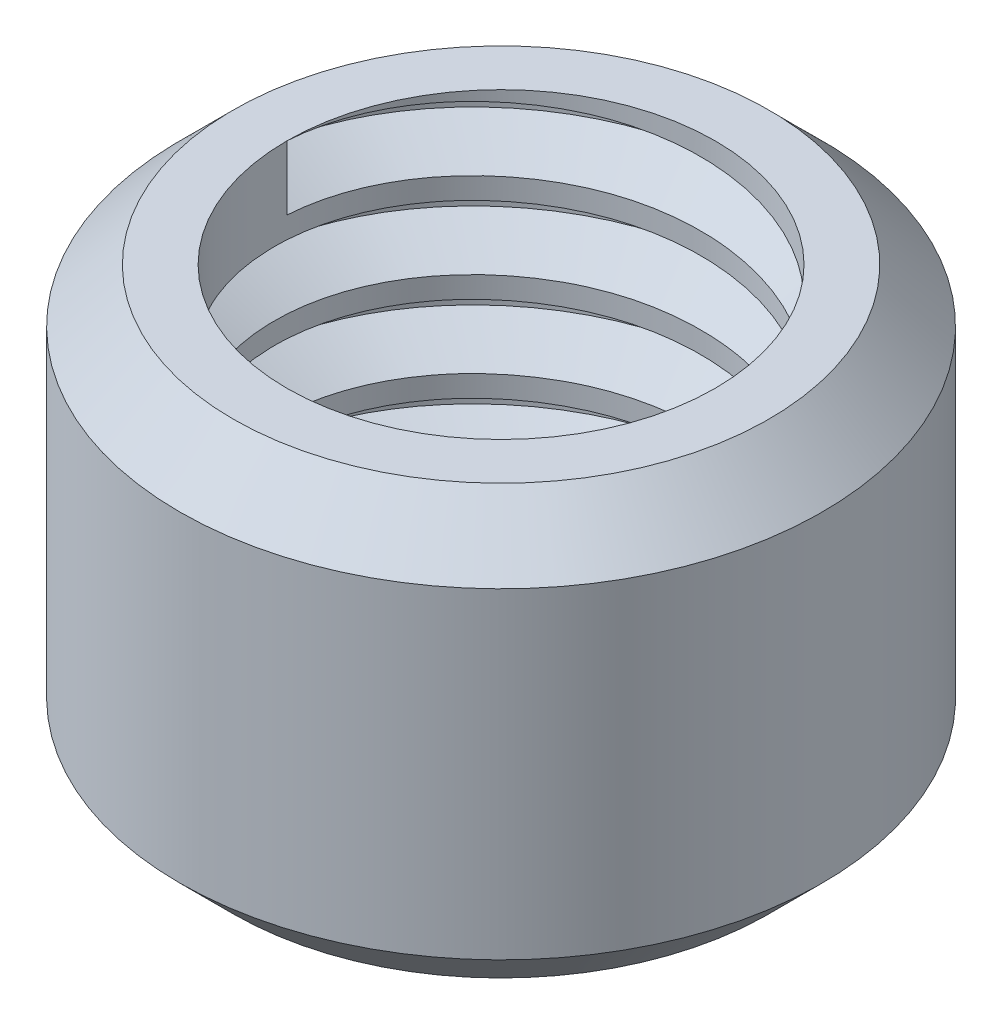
SolidWorks part; units mm, degrees
ref_plane "Front Plane" through (0, 0, 0) normal (0, 0, 1) x (1, 0, 0)
ref_plane "Top Plane" through (0, 0, 0) normal (0, 1, 0) x (1, 0, 0)
ref_plane "Right Plane" through (0, 0, 0) normal (1, 0, 0) x (0, 0, -1)
sketch "Sketch1" plane through (0, 0, 0) normal (0, 1, 0) x (1, 0, 0)
  circle A0 centre (0, 0) radius 1.5
extrude "Boss-Extrude1" add sketch "Sketch1" along normal blind 2
sketch "Sketch2" plane through (0, 2, 0) normal (0, 1, 0) x (1, 0, 0)
  circle A0 centre (0, 0) radius 1
extrude "Cut-Extrude1" cut sketch "Sketch2" against normal blind 3
thread "Thread1" pitch 0.4 start angle 0, offset 0, length 10, pitch 0.4, diameter 2
ref_plane "Plane1" through (-1, 2, 0) normal (0, 0, 1) x (-1, 0, 0)
sketch "Thread Profile1" plane through (-1, 2, 0) normal (0, 0, 1) x (-1, 0, 0)
  line L0 (0, 0) -> (0, 0.4) construction
  line L1 (0, 0) -> (0.2165, 0.125)
  line L2 (0.2165, 0.125) -> (0.2165, 0.175)
  line L3 (0.2165, 0.175) -> (0, 0.3)
  line L4 (0.2165, 0.15) -> (0, 0.15) construction
  line L11 (0, 0) -> (0, 0.3)
  point P2 (0, 0)
  dimension "Pitch" = 0.4
  dimension "Profile_Angle" = 60
  dimension "Profile_Land" = 0.05
  dimension "Profile_Height" = 0.2165
chamfer "Chamfer1" distance 0.25 angle 45 2 edges at (0, 0, 1.5) (0, 2, 1.5)
